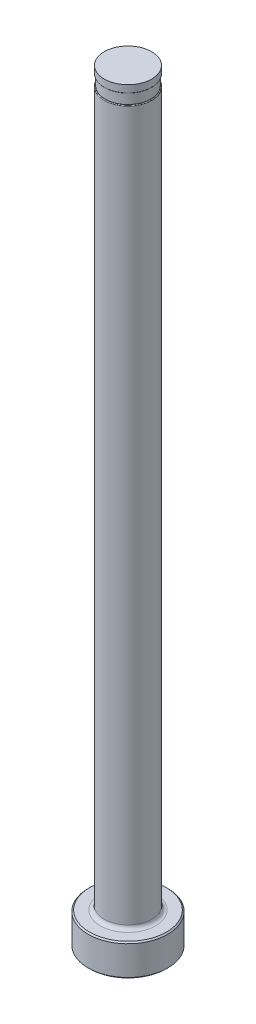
SolidWorks part; units mm, degrees
ref_plane "Front Plane" through (0, 0, 0) normal (0, 0, 1) x (1, 0, 0)
ref_plane "Top Plane" through (0, 0, 0) normal (0, 1, 0) x (1, 0, 0)
ref_plane "Right Plane" through (0, 0, 0) normal (1, 0, 0) x (0, 0, -1)
other "Configuration Table"
sketch "Sketch1" plane through (0, 0, 0) normal (0, 0, 1) x (1, 0, 0)
  line L0 (0, 259.9588) -> (0, -15.1925) construction
  line L1 (0, 0) -> (-7.9375, 0)
  line L2 (-7.9375, 0) -> (-7.9375, 6.35)
  line L3 (-7.9375, 6.35) -> (-4.7625, 6.35)
  line L4 (-4.7625, 6.35) -> (-4.7625, 152.4)
  line L5 (-4.7625, 152.4) -> (0, 152.4)
  line L6 (0, 152.4) -> (0, 0)
  dimension "L" = 152.4
  dimension "H" = 15.875
  dimension "T" = 6.35
  dimension "D" = 9.525
revolve "Revolve1" add sketch "Sketch1" angle 360 about L0
chamfer "Chamfer1" distance 0.254 angle 45 2 edges at (0, 6.35, 7.9375) (0, 0, 7.9375)
fillet "Fillet1" radius 0.762 1 edges at (0, 6.35, 4.7625)
sketch "Sketch2" plane through (0, 0, 0) normal (0, 0, 1) x (1, 0, 0)
  line L0 (-4.7625, 152.4) -> (-4.7625, 7.112) construction
  line L1 (-4.7625, 150.876) -> (-4.5593, 150.876)
  line L2 (-4.7625, 150.876) -> (-4.7625, 148.844)
  line L3 (-4.7625, 148.844) -> (-4.5593, 148.844)
  line L4 (-4.5593, 150.876) -> (-4.5593, 148.844)
  line L5 (4.7625, 152.4) -> (-4.7625, 152.4) construction
  line L6 (0, 153.4483) -> (0, 147.3282) construction
  dimension "D1" = 2.032
  dimension "N" = 1.524
  dimension "FD" = 0.2032
  dimension "D3" = 9.1186
revolve "Vent Relief" cut sketch "Sketch2" angle 360 about L6
sketch "Sketch3" plane through (0, 0, 0) normal (0, 0, 1) x (1, 0, 0)
  line L0 (-4.5593, 149.86) -> (-4.5593, 86.36)
  line L1 (-4.5593, 150.876) -> (-4.5593, 148.844) construction
  line L2 (-4.7625, 148.844) -> (-4.7625, 7.112) construction
  line L3 (-4.7625, 85.2424) -> (-4.7625, 149.86)
  line L4 (-4.7625, 149.86) -> (-4.5593, 149.86)
  arc A0 (-4.5593, 86.36) -> (-4.7625, 85.2424) centre (-7.7343, 86.36) cw
  dimension "D1" = 3.175
  dimension "D2" = 63.5
extrude "D-Slot" cut sketch "Sketch3" against normal through all both and the other way through all
sketch "Sketch5" plane through (0, 0, 0) normal (0, 0, 1) x (1, 0, 0)
  line L0 (-4.7625, 150.876) -> (4.7625, 150.876) construction
  line L1 (-4.7625, 152.4) -> (-4.7371, 152.4)
  line L2 (-4.7625, 152.4) -> (-4.7625, 150.876)
  line L3 (-4.7625, 150.876) -> (-4.7371, 150.876)
  line L4 (-4.7371, 152.4) -> (-4.7371, 150.876)
  line L5 (0, 152.6877) -> (0, 150.5771) construction
  dimension "VP" = 0.0254
revolve "Vent Diameter" cut sketch "Sketch5" angle 360 about L5
fillet "Fillet2" radius 0.127 2 edges at (4.7625, 148.844, 0) (0, 150.876, 4.7371)
sketch "Pocket Sketch" plane through (0, 0, 0) normal (0, 0, 1) x (1, 0, 0)
  line L0 (-8.3344, 0) -> (-8.3344, 6.3754)
  line L1 (-8.3344, 6.3754) -> (-5.7229, 6.3754)
  line L2 (-4.9609, 7.1374) -> (-4.9609, 22.225)
  line L3 (-4.9609, 22.225) -> (0, 22.225)
  line L4 (0, 22.225) -> (0, 0)
  line L5 (0, 0) -> (-8.3344, 0)
  line L6 (0, 12.6104) -> (0, -2.4989) construction
  line L7 (-7.9375, 6.096) -> (-7.9375, 0.254) construction
  line L8 (7.6835, 6.35) -> (-7.6835, 6.35) construction
  line L9 (-4.7625, 85.2424) -> (-4.7625, 7.112) construction
  line L10 (-5.7229, 6.3754) -> (-4.9609, 7.1374)
  point P3 (-4.9609, 6.3754)
  dimension "D1" = 16.6687
  dimension "D2" = 0.3969
  dimension "D3" = 0.0254
  dimension "D4" = 0.1984
  dimension "D5" = 9.9219
  dimension "D6" = 22.225
